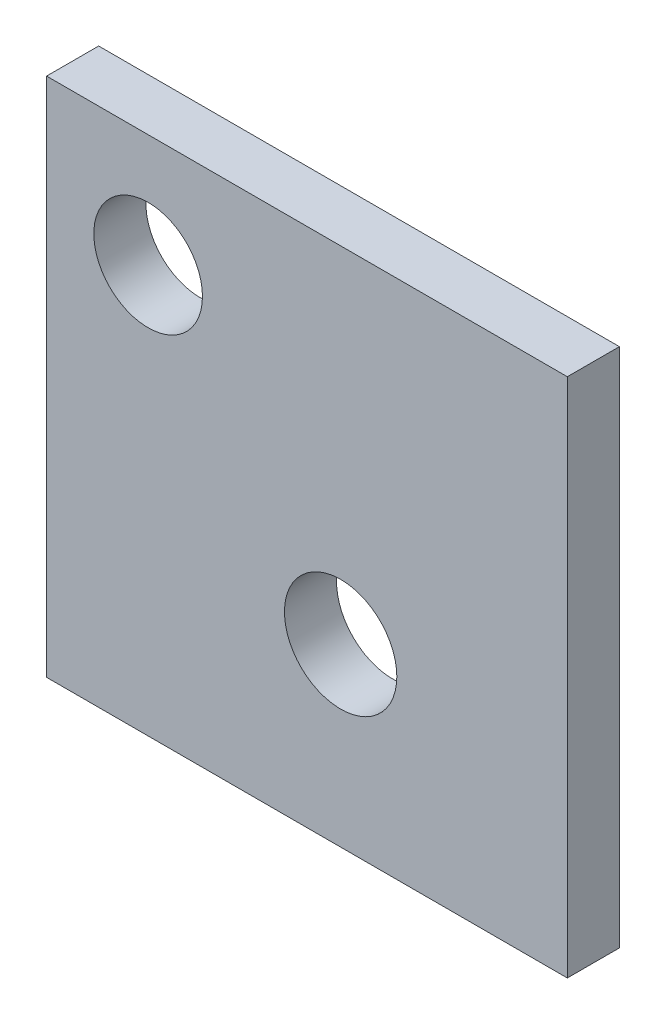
SolidWorks part; units mm, degrees
ref_plane "Plan de face" through (0, 0, 0) normal (0, 0, 1) x (1, 0, 0)
ref_plane "Plan de dessus" through (0, 0, 0) normal (0, 1, 0) x (1, 0, 0)
ref_plane "Plan de droite" through (0, 0, 0) normal (1, 0, 0) x (0, 0, -1)
sketch "Esquisse1" plane through (0, 0, 0) normal (0, 0, 1) x (1, 0, 0)
  line L1 (-50, 50) -> (50, 50)
  line L2 (-50, 50) -> (-50, -50)
  line L3 (-50, -50) -> (50, -50)
  line L4 (50, 50) -> (50, -50)
  line L5 (-50, 50) -> (50, -50) construction
  line L6 (-50, -50) -> (50, 50) construction
  point P0 (0, 0)
  dimension "D1" = 100
extrude "Boss.-Extru.1" add sketch "Esquisse1" along normal blind 10
sketch "Esquisse2" plane through (0, 0, 10) normal (0, 0, 1) x (1, 0, 0)
  circle A0 centre (-30.5003, 28.3197) radius 10.4299
extrude "Enlèv. mat.-Extru.1" cut sketch "Esquisse2" against normal through all
sketch "Esquisse3" plane through (0, 0, 10) normal (0, 0, 1) x (1, 0, 0)
  circle A0 centre (6.4688, -16.2573) radius 10.7886
extrude "Enlèv. mat.-Extru.2" cut sketch "Esquisse3" against normal through all
